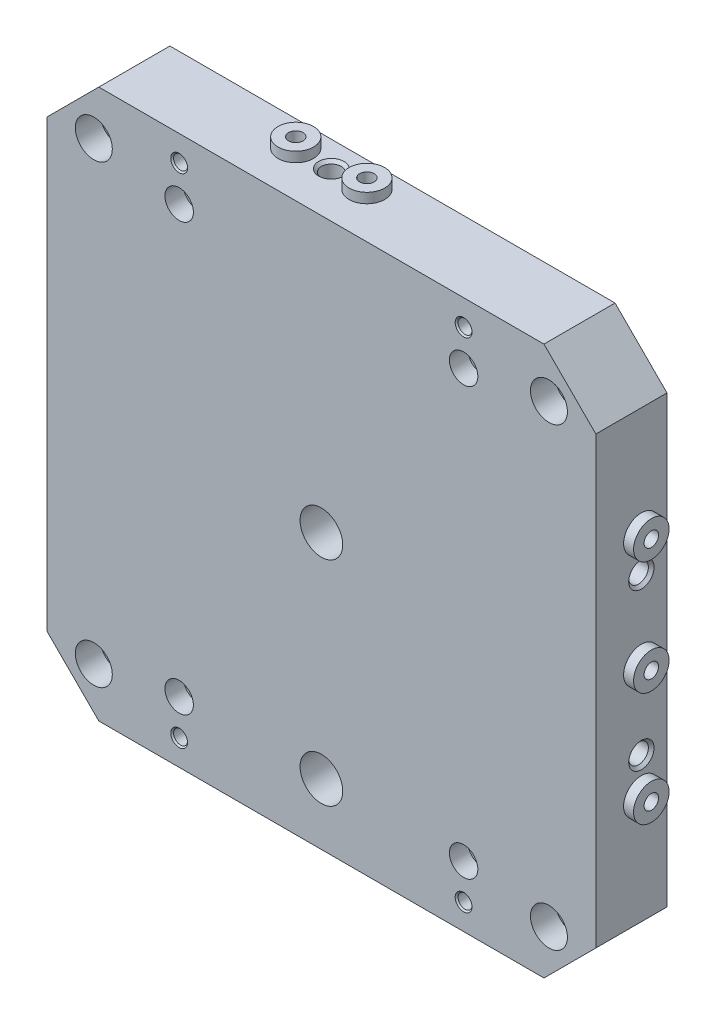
SolidWorks part; units mm, degrees
ref_plane "Plan de face" through (0, 0, 0) normal (0, 0, 1) x (1, 0, 0)
ref_plane "Plan de dessus" through (0, 0, 0) normal (0, 1, 0) x (1, 0, 0)
ref_plane "Plan de droite" through (0, 0, 0) normal (1, 0, 0) x (0, 0, -1)
sketch "Esquisse1" plane through (0, 0, 0) normal (0, 0, 1) x (1, 0, 0)
  line L0 (-193, -156.5) -> (-156.5, -193)
  line L1 (-156.5, -193) -> (156.5, -193)
  line L2 (156.5, -193) -> (193, -156.5)
  line L3 (193, -156.5) -> (193, 156.5)
  line L4 (193, 156.5) -> (156.5, 193)
  line L5 (156.5, 193) -> (-156.5, 193)
  line L6 (-156.5, 193) -> (-193, 156.5)
  line L7 (-193, 156.5) -> (-193, -156.5)
extrude "Boss.-Extru.1" add sketch "Esquisse1" along normal blind 50
ref_plane "Plan4" through (0, 193, 0) normal (0, 1, 0) x (-1, 0, 0)
sketch "Esquisse2" plane through (0, 193, 0) normal (0, 1, 0) x (-1, 0, 0)
  circle A0 centre (0, 18) radius 12.5
extrude "Boss.-Extru.2" add sketch "Esquisse2" along normal blind 7
sketch "Esquisse3" plane through (0, 193, 0) normal (0, 1, 0) x (-1, 0, 0)
  circle A0 centre (50, 18) radius 12.5
extrude "Boss.-Extru.3" add sketch "Esquisse3" along normal blind 7
ref_plane "Plan5" through (0, 160, 0) normal (0, 1, 0) x (-1, 0, 0)
sketch "Esquisse4" plane through (0, 160, 0) normal (0, 1, 0) x (-1, 0, 0)
  line L0 (160, -1) -> (151.25, -1)
  line L1 (151.25, -1) -> (151.25, 32.5)
  line L2 (151.25, 32.5) -> (147, 32.5)
  line L3 (147, 32.5) -> (147, 51)
  line L4 (147, 51) -> (160, 51)
  line L5 (160, 51) -> (160, -1)
  line L6 (160, 51) -> (160, -1) construction
revolve "Enlèvement de matière-Révolution1" cut sketch "Esquisse4" angle 360 about L6
sketch "Esquisse5" plane through (0, 160, 0) normal (0, 1, 0) x (-1, 0, 0)
  line L0 (-160, -1) -> (-168.75, -1)
  line L1 (-168.75, -1) -> (-168.75, 32.5)
  line L2 (-168.75, 32.5) -> (-173, 32.5)
  line L3 (-173, 32.5) -> (-173, 51)
  line L4 (-173, 51) -> (-160, 51)
  line L5 (-160, 51) -> (-160, -1)
  line L6 (-160, 51) -> (-160, -1) construction
revolve "Enlèvement de matière-Révolution2" cut sketch "Esquisse5" angle 360 about L6
ref_plane "Plan6" through (0, -160, 0) normal (0, 1, 0) x (-1, 0, 0)
sketch "Esquisse6" plane through (0, -160, 0) normal (0, 1, 0) x (-1, 0, 0)
  line L0 (-160, -1) -> (-168.75, -1)
  line L1 (-168.75, -1) -> (-168.75, 32.5)
  line L2 (-168.75, 32.5) -> (-173, 32.5)
  line L3 (-173, 32.5) -> (-173, 51)
  line L4 (-173, 51) -> (-160, 51)
  line L5 (-160, 51) -> (-160, -1)
  line L6 (-160, 51) -> (-160, -1) construction
revolve "Enlèvement de matière-Révolution3" cut sketch "Esquisse6" angle 360 about L6
sketch "Esquisse7" plane through (0, -160, 0) normal (0, 1, 0) x (-1, 0, 0)
  line L0 (160, -1) -> (151.25, -1)
  line L1 (151.25, -1) -> (151.25, 32.5)
  line L2 (151.25, 32.5) -> (147, 32.5)
  line L3 (147, 32.5) -> (147, 51)
  line L4 (147, 51) -> (160, 51)
  line L5 (160, 51) -> (160, -1)
  line L6 (160, 51) -> (160, -1) construction
revolve "Enlèvement de matière-Révolution4" cut sketch "Esquisse7" angle 360 about L6
sketch "Esquisse8" plane through (0, 0, 0) normal (0, 1, 0) x (1, 0, 0)
  line L0 (0, 1) -> (15, 1)
  line L1 (15, 1) -> (15, -51)
  line L2 (15, -51) -> (0, -51)
  line L3 (0, -51) -> (0, 1)
  line L4 (0, -51) -> (0, 1) construction
revolve "Enlèvement de matière-Révolution5" cut sketch "Esquisse8" angle 360 about L4
ref_plane "Plan7" through (0, -150, 0) normal (0, 1, 0) x (-1, 0, 0)
sketch "Esquisse9" plane through (0, -150, 0) normal (0, 1, 0) x (-1, 0, 0)
  line L0 (0, -1) -> (-15, -1)
  line L1 (-15, -1) -> (-15, 51)
  line L2 (-15, 51) -> (0, 51)
  line L3 (0, 51) -> (0, -1)
  line L4 (0, 51) -> (0, -1) construction
revolve "Enlèvement de matière-Révolution6" cut sketch "Esquisse9" angle 360 about L4
ref_plane "Plan8" through (0, 150, 0) normal (0, 1, 0) x (-1, 0, 0)
sketch "Esquisse10" plane through (0, 150, 0) normal (0, 1, 0) x (-1, 0, 0)
  line L0 (-100, 51) -> (-90, 51)
  line L1 (-90, 51) -> (-90, 37)
  line L2 (-90, 37) -> (-93.25, 37)
  line L3 (-93.25, 37) -> (-93.25, -1)
  line L4 (-93.25, -1) -> (-100, -1)
  line L5 (-100, -1) -> (-100, 51)
  line L6 (-100, -1) -> (-100, 51) construction
revolve "Enlèvement de matière-Révolution7" cut sketch "Esquisse10" angle 360 about L6
sketch "Esquisse11" plane through (0, 150, 0) normal (0, 1, 0) x (-1, 0, 0)
  line L0 (100, 51) -> (110, 51)
  line L1 (110, 51) -> (110, 37)
  line L2 (110, 37) -> (106.75, 37)
  line L3 (106.75, 37) -> (106.75, -1)
  line L4 (106.75, -1) -> (100, -1)
  line L5 (100, -1) -> (100, 51)
  line L6 (100, -1) -> (100, 51) construction
revolve "Enlèvement de matière-Révolution8" cut sketch "Esquisse11" angle 360 about L6
ref_plane "Plan9" through (0, -150, 0) normal (0, 1, 0) x (-1, 0, 0)
sketch "Esquisse12" plane through (0, -150, 0) normal (0, 1, 0) x (-1, 0, 0)
  line L0 (-100, 51) -> (-90, 51)
  line L1 (-90, 51) -> (-90, 37)
  line L2 (-90, 37) -> (-93.25, 37)
  line L3 (-93.25, 37) -> (-93.25, -1)
  line L4 (-93.25, -1) -> (-100, -1)
  line L5 (-100, -1) -> (-100, 51)
  line L6 (-100, -1) -> (-100, 51) construction
revolve "Enlèvement de matière-Révolution9" cut sketch "Esquisse12" angle 360 about L6
sketch "Esquisse13" plane through (0, -150, 0) normal (0, 1, 0) x (-1, 0, 0)
  line L0 (100, 51) -> (110, 51)
  line L1 (110, 51) -> (110, 37)
  line L2 (110, 37) -> (106.75, 37)
  line L3 (106.75, 37) -> (106.75, -1)
  line L4 (106.75, -1) -> (100, -1)
  line L5 (100, -1) -> (100, 51)
  line L6 (100, -1) -> (100, 51) construction
revolve "Enlèvement de matière-Révolution10" cut sketch "Esquisse13" angle 360 about L6
ref_plane "Plan10" through (0, 175, 0) normal (0, 1, 0) x (-1, 0, 0)
sketch "Esquisse14" plane through (0, 175, 0) normal (0, 1, 0) x (-1, 0, 0)
  line L0 (100, -2) -> (92.083, -2)
  line L1 (92.083, -2) -> (95.083, 1)
  line L2 (95.083, 1) -> (95.083, 49)
  line L3 (95.083, 49) -> (92.083, 52)
  line L4 (92.083, 52) -> (100, 52)
  line L5 (100, 52) -> (100, -2)
  line L6 (100, 52) -> (100, -2) construction
revolve "Enlèvement de matière-Révolution11" cut sketch "Esquisse14" angle 360 about L6
sketch "Esquisse15" plane through (0, 175, 0) normal (0, 1, 0) x (-1, 0, 0)
  line L0 (-100, -2) -> (-107.917, -2)
  line L1 (-107.917, -2) -> (-104.917, 1)
  line L2 (-104.917, 1) -> (-104.917, 49)
  line L3 (-104.917, 49) -> (-107.917, 52)
  line L4 (-107.917, 52) -> (-100, 52)
  line L5 (-100, 52) -> (-100, -2)
  line L6 (-100, 52) -> (-100, -2) construction
revolve "Enlèvement de matière-Révolution12" cut sketch "Esquisse15" angle 360 about L6
ref_plane "Plan11" through (0, -175, 0) normal (0, 1, 0) x (-1, 0, 0)
sketch "Esquisse16" plane through (0, -175, 0) normal (0, 1, 0) x (-1, 0, 0)
  line L0 (100, -2) -> (92.083, -2)
  line L1 (92.083, -2) -> (95.083, 1)
  line L2 (95.083, 1) -> (95.083, 49)
  line L3 (95.083, 49) -> (92.083, 52)
  line L4 (92.083, 52) -> (100, 52)
  line L5 (100, 52) -> (100, -2)
  line L6 (100, 52) -> (100, -2) construction
revolve "Enlèvement de matière-Révolution13" cut sketch "Esquisse16" angle 360 about L6
sketch "Esquisse17" plane through (0, -175, 0) normal (0, 1, 0) x (-1, 0, 0)
  line L0 (-100, -2) -> (-107.917, -2)
  line L1 (-107.917, -2) -> (-104.917, 1)
  line L2 (-104.917, 1) -> (-104.917, 49)
  line L3 (-104.917, 49) -> (-107.917, 52)
  line L4 (-107.917, 52) -> (-100, 52)
  line L5 (-100, 52) -> (-100, -2)
  line L6 (-100, 52) -> (-100, -2) construction
revolve "Enlèvement de matière-Révolution14" cut sketch "Esquisse17" angle 360 about L6
sketch "Esquisse18" plane through (0, 0, 0) normal (0, 1, 0) x (1, 0, 0)
  line L0 (150, -51) -> (140, -51)
  line L1 (140, -51) -> (140, -37)
  line L2 (140, -37) -> (143.25, -37)
  line L3 (143.25, -37) -> (143.25, 1)
  line L4 (143.25, 1) -> (150, 1)
  line L5 (150, 1) -> (150, -51)
  line L6 (150, 1) -> (150, -51) construction
revolve "Enlèvement de matière-Révolution15" [suppressed] cut sketch "Esquisse18" angle 360 about L6
sketch "Esquisse19" plane through (0, 0, 0) normal (0, 1, 0) x (1, 0, 0)
  line L0 (-150, -51) -> (-160, -51)
  line L1 (-160, -51) -> (-160, -37)
  line L2 (-160, -37) -> (-156.75, -37)
  line L3 (-156.75, -37) -> (-156.75, 1)
  line L4 (-156.75, 1) -> (-150, 1)
  line L5 (-150, 1) -> (-150, -51)
  line L6 (-150, 1) -> (-150, -51) construction
revolve "Enlèvement de matière-Révolution16" [suppressed] cut sketch "Esquisse19" angle 360 about L6
ref_plane "Plan12" through (-25, 0, 0) normal (1, 0, 0) x (0, 0, -1)
sketch "Esquisse20" plane through (-25, 0, 0) normal (1, 0, 0) x (0, 0, -1)
  line L0 (-18, 194) -> (-8.0825, 194)
  line L1 (-8.0825, 194) -> (-11.0825, 191)
  line L2 (-11.0825, 191) -> (-11.0825, 127.9938)
  line L3 (-11.0825, 127.9938) -> (-18, 124)
  line L4 (-18, 124) -> (-18, 194)
  line L5 (-18, 124) -> (-18, 194) construction
revolve "Enlèvement de matière-Révolution17" cut sketch "Esquisse20" angle 360 about L5
ref_plane "Plan13" through (193, 0, 0) normal (1, 0, 0) x (0, 0, -1)
sketch "Esquisse21" plane through (193, 0, 0) normal (1, 0, 0) x (0, 0, -1)
  circle A0 centre (-18, 0) radius 12.5
extrude "Boss.-Extru.4" add sketch "Esquisse21" along normal blind 7
sketch "Esquisse22" plane through (193, 0, 0) normal (1, 0, 0) x (0, 0, -1)
  circle A0 centre (-18, 80) radius 12.5
extrude "Boss.-Extru.5" add sketch "Esquisse22" along normal blind 7
sketch "Esquisse23" plane through (193, 0, 0) normal (1, 0, 0) x (0, 0, -1)
  circle A0 centre (-18, -80) radius 12.5
extrude "Boss.-Extru.6" add sketch "Esquisse23" along normal blind 7
ref_plane "Plan14" through (0, 55, 0) normal (0, 1, 0) x (-1, 0, 0)
sketch "Esquisse24" plane through (0, 55, 0) normal (0, 1, 0) x (-1, 0, 0)
  line L0 (-194, 18) -> (-194, 27.9175)
  line L1 (-194, 27.9175) -> (-191, 24.9175)
  line L2 (-191, 24.9175) -> (-127.9938, 24.9175)
  line L3 (-127.9938, 24.9175) -> (-124, 18)
  line L4 (-124, 18) -> (-194, 18)
  line L5 (-124, 18) -> (-194, 18) construction
revolve "Enlèvement de matière-Révolution18" cut sketch "Esquisse24" angle 360 about L5
ref_plane "Plan15" through (0, -55, 0) normal (0, 1, 0) x (-1, 0, 0)
sketch "Esquisse25" plane through (0, -55, 0) normal (0, 1, 0) x (-1, 0, 0)
  line L0 (-194, 18) -> (-194, 27.9175)
  line L1 (-194, 27.9175) -> (-191, 24.9175)
  line L2 (-191, 24.9175) -> (-127.9938, 24.9175)
  line L3 (-127.9938, 24.9175) -> (-124, 18)
  line L4 (-124, 18) -> (-194, 18)
  line L5 (-124, 18) -> (-194, 18) construction
revolve "Enlèvement de matière-Révolution19" cut sketch "Esquisse25" angle 360 about L5
ref_plane "Plan16" through (0, 200, 0) normal (0, 1, 0) x (-1, 0, 0)
sketch "Esquisse26" plane through (0, 200, 0) normal (0, 1, 0) x (-1, 0, 0)
  circle A0 centre (0, 18) radius 5
extrude "Enlèv. mat.-Extru.1" cut sketch "Esquisse26" along normal blind 25 and the other way blind 25
ref_plane "Plan17" through (0, 200, 0) normal (0, 1, 0) x (-1, 0, 0)
sketch "Esquisse27" plane through (0, 200, 0) normal (0, 1, 0) x (-1, 0, 0)
  circle A0 centre (50, 18) radius 5
extrude "Enlèv. mat.-Extru.2" cut sketch "Esquisse27" along normal blind 25 and the other way blind 25
ref_plane "Plan18" through (200, 0, 0) normal (1, 0, 0) x (0, 0, -1)
sketch "Esquisse28" plane through (200, 0, 0) normal (1, 0, 0) x (0, 0, -1)
  circle A0 centre (-18, 80) radius 5
extrude "Enlèv. mat.-Extru.3" cut sketch "Esquisse28" along normal blind 25 and the other way blind 25
ref_plane "Plan19" through (200, 0, 0) normal (1, 0, 0) x (0, 0, -1)
sketch "Esquisse29" plane through (200, 0, 0) normal (1, 0, 0) x (0, 0, -1)
  circle A0 centre (-18, 0) radius 5
extrude "Enlèv. mat.-Extru.4" cut sketch "Esquisse29" along normal blind 25 and the other way blind 25
ref_plane "Plan20" through (200, 0, 0) normal (1, 0, 0) x (0, 0, -1)
sketch "Esquisse30" plane through (200, 0, 0) normal (1, 0, 0) x (0, 0, -1)
  circle A0 centre (-18, -80) radius 5
extrude "Enlèv. mat.-Extru.5" cut sketch "Esquisse30" along normal blind 25 and the other way blind 25
hole_wizard "Trou taraudé M121" positions "Esquisse32" profile "Esquisse31" tap size "M12" standard "ISO"
sketch "Esquisse32" plane through (200, 0, 0) normal (1, 0, 0) x (0, 0, -1)
  point P0 (-18, 80)
  point P1 (-18, 0)
  point P4 (-18, -80)
sketch "Esquisse31" plane through (200, 80, 18) normal (0, 1, 0) x (0, 0, -1)
  line L0 (0, 0) -> (0, 35.8144)
  line L1 (0, 35.8144) -> (5.1, 32.75)
  line L2 (5.1, 32.75) -> (5.1, 0)
  line L5 (5.1, 0) -> (0, 0)
  line L10 (0, 35.8144) -> (-5.1, 32.75) construction
  line L11 (0, -6.35) -> (0, 107.95) construction
  dimension "Diamètre du trou pour taraudage" = 10.2
  dimension "Profondeur du trou pour taraudage" = 32.75
  dimension "Angle de pointe" = 118
hole_wizard "Trou taraudé M122" positions "Esquisse34" profile "Esquisse33" tap size "M12" standard "ISO"
sketch "Esquisse34" plane through (0, 200, 0) normal (0, 1, 0) x (-1, 0, 0)
  point P0 (0, 18)
  point P1 (50, 18)
sketch "Esquisse33" plane through (0, 200, 18) normal (1, 0, 0) x (0, 0, 1)
  line L0 (0, 0) -> (0, 35.8144)
  line L1 (0, 35.8144) -> (5.1, 32.75)
  line L2 (5.1, 32.75) -> (5.1, 0)
  line L5 (5.1, 0) -> (0, 0)
  line L10 (0, 35.8144) -> (-5.1, 32.75) construction
  line L11 (0, -6.35) -> (0, 107.95) construction
  dimension "Diamètre du trou pour taraudage" = 10.2
  dimension "Profondeur du trou pour taraudage" = 32.75
  dimension "Angle de pointe" = 118
